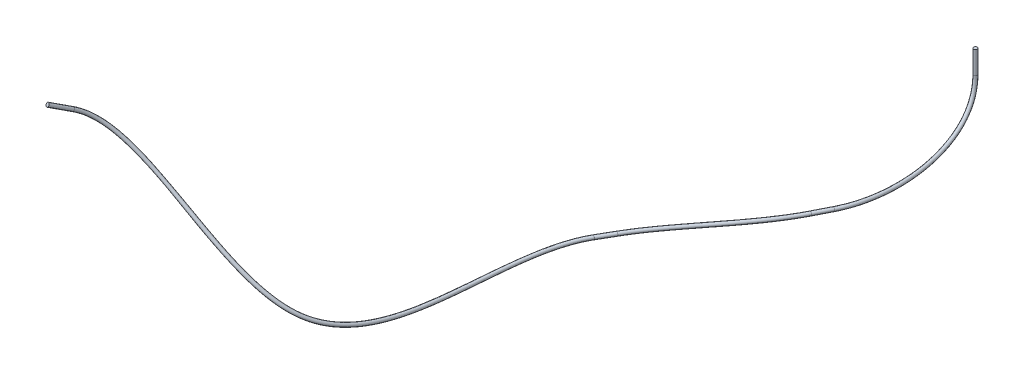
SolidWorks part; units mm, degrees
ref_plane "Front Plane" through (0, 0, 0) normal (0, 0, 1) x (1, 0, 0)
ref_plane "Top Plane" through (0, 0, 0) normal (0, 1, 0) x (1, 0, 0)
ref_plane "Right Plane" through (0, 0, 0) normal (1, 0, 0) x (0, 0, -1)
sketch3d "3DSketch1"
  line L6 (-8.9078, 81.1206, 286.5405) -> (-6.1523, 76.5773, 278.0601) construction
  line L7 (86.5842, 4.7625, 140.0786) -> (90.3942, 4.7625, 133.4794) construction
  line L8 (128.9692, 4.7625, 76.0418) -> (125.5098, 4.7625, 82.8313) construction
  line L9 (129.032, 35.2425, 13.3985) -> (129.032, 25.2349, 13.3985) construction
  line L10 (-8.9078, 81.1206, 286.5405) -> (-6.1523, 76.5773, 278.0601)
  line L11 (86.5842, 4.7625, 140.0786) -> (90.3942, 4.7625, 133.4794)
  line L12 (128.9692, 4.7625, 76.0418) -> (125.5098, 4.7625, 82.8313)
  line L13 (129.032, 35.2425, 13.3985) -> (129.032, 25.2349, 13.3985)
  spline S3 degree 3 poles (9551.4821, -6721.1538, 11145.4003) (-1000.2523, 921.2087, -560.1102) (1048.7071, -833.2301, 1412.82) (-812.2451, 762.0937, -1379.7127) (10255.6407, -5353.6043, 11247.8342) knots -2.397062 -2.397062 -2.397062 -2.397062 0.476194 3.771033 3.771033 3.771033 3.771033 only from (-6.1523, 76.5773, 278.0601) to (86.5842, 4.7625, 140.0786) construction
  spline S4 degree 3 poles (14107.3975, 4.7625, 7801.1663) (-14410.3614, 4.7625, -6927.4644) (14599.9071, 4.7625, 7190.432) (-13822.384, 4.7625, -7706.5404) knots -10.162084 -10.162084 -10.162084 -10.162084 11.08205 11.08205 11.08205 11.08205 only from (90.3942, 4.7625, 133.4794) to (125.5098, 4.7625, 82.8313) construction
  spline S5 degree 3 poles (5789.7273, 7878.5496, 12732.1227) (-6247.4691, -7319.9154, -13205.2952) (7232.126, 6804.899, 13212.9256) (-7673.7188, -6296.7479, -12363.2716) knots -5.295551 -5.295551 -5.295551 -5.295551 6.593649 6.593649 6.593649 6.593649 only from (129.032, 25.2349, 13.3985) to (128.9692, 4.7625, 76.0418) construction
  spline S6 degree 3 poles (-6.1523, 76.5773, 278.0601) (1.7873, 63.4859, 253.6243) (87.6289, -9.8991, 273.2354) (70.7009, 4.7625, 167.5893) (86.5842, 4.7625, 140.0786) knots 0 0 0 0 0.476194 1 1 1 1
  spline S7 degree 3 poles (90.3942, 4.7625, 133.4794) (100.4751, 4.7625, 116.0189) (116.177, 4.7625, 101.1478) (125.5098, 4.7625, 82.8313) knots 0 0 0 0 1 1 1 1
  spline S8 degree 3 poles (129.032, 25.2349, 13.3985) (129.032, 0.3703, 13.3985) (139.7023, 4.7625, 54.9769) (128.9692, 4.7625, 76.0418) knots 0 0 0 0 1 1 1 1
ref_plane "Plane1" through (-8.9078, 81.1206, 286.5405) normal (0.2753, -0.454, -0.8474) x (-0.9613, -0.13, -0.2427)
sketch "PipeSketch" plane through (-8.9078, 81.1206, 286.5405) normal (0.2753, -0.454, -0.8474) x (-0.9613, -0.13, -0.2427)
  circle A0 centre (0, 0) radius 0.813
  dimension "OuterDiameter" = 1.626
sweep "Cable_1" add profiles "PipeSketch" path "3DSketch1"
